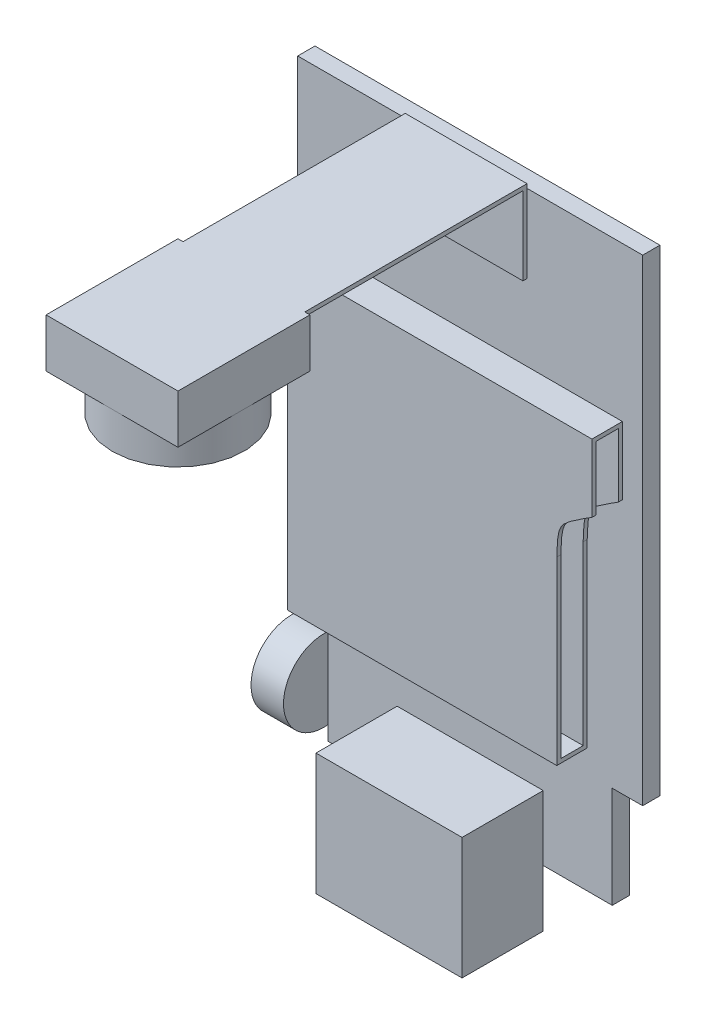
SolidWorks part; units mm, degrees
ref_plane "Front Plane" through (0, 0, 0) normal (0, 0, 1) x (1, 0, 0)
ref_plane "Top Plane" through (0, 0, 0) normal (0, 1, 0) x (1, 0, 0)
ref_plane "Right Plane" through (0, 0, 0) normal (1, 0, 0) x (0, 0, -1)
imported_body "3202 Spy Camera.step<1>"
sketch "Sketch13" plane through (0, 0, 0) normal (0, 0, -1) x (-1, 0, 0)
  line L0 (-5.3, 40.05) -> (-5.3, 24.65) construction
  line L1 (-5.3, 28.5) -> (-11.3, 28.5)
  line L2 (-5.3, 28.5) -> (-5.3, 28.7)
  line L3 (-5.3, 28.7) -> (-11.3, 28.7)
  line L4 (-11.3, 28.5) -> (-11.3, 28.7)
  line L5 (-11.3, 24.65) -> (-11.3, 40.05) construction
  line L6 (0, 28.5) -> (-17, 28.5) construction
  dimension "D1" = 0.2
extrude "Boss-Extrude2" add sketch "Sketch13" against normal blind 10.95
sketch "Sketch14" plane through (0, 0, 10.95) normal (0, 0, 1) x (1, 0, 0)
  line L0 (11.55, 26.3) -> (5.05, 26.3)
  line L1 (5.3, 28.7) -> (11.3, 28.7) construction
  line L2 (5.3, 28.7) -> (11.3, 28.7) construction
  line L5 (11.55, 26.3) -> (11.55, 28.7)
  line L7 (11.55, 28.7) -> (5.05, 28.7)
  line L9 (5.05, 28.7) -> (5.05, 26.3)
  point P8 (8.3, 28.7)
  point P9 (8.3, 28.7)
  dimension "D1" = 6.5
  dimension "D2" = 2.4
extrude "Boss-Extrude3" add sketch "Sketch14" along normal blind 6.5
sketch "Sketch17" plane through (0, 26.3, 0) normal (0, 1, 0) x (1, 0, 0)
  line L0 (11.55, -17.45) -> (5.05, -10.95) construction
  line L1 (5.05, -17.45) -> (11.55, -10.95) construction
  circle A0 centre (8.3, -14.2) radius 3.25
  dimension "D1" = 6.5
extrude "Boss-Extrude5" add sketch "Sketch17" against normal blind 1.8
sketch "Sketch18" plane through (0, 0, 0) normal (0, 0, -1) x (-1, 0, 0)
  line L0 (-5.3, 28.7) -> (-11.3, 28.7) construction
  line L1 (-11.55, 46.55) -> (-4.3836, 46.55)
  line L2 (-11.55, 46.55) -> (-11.55, 28.7)
  line L3 (-11.55, 28.7) -> (-4.3836, 28.7)
  line L4 (-4.3836, 46.55) -> (-4.3836, 28.7)
extrude "Cut-Extrude1" cut sketch "Sketch18" against normal through all
